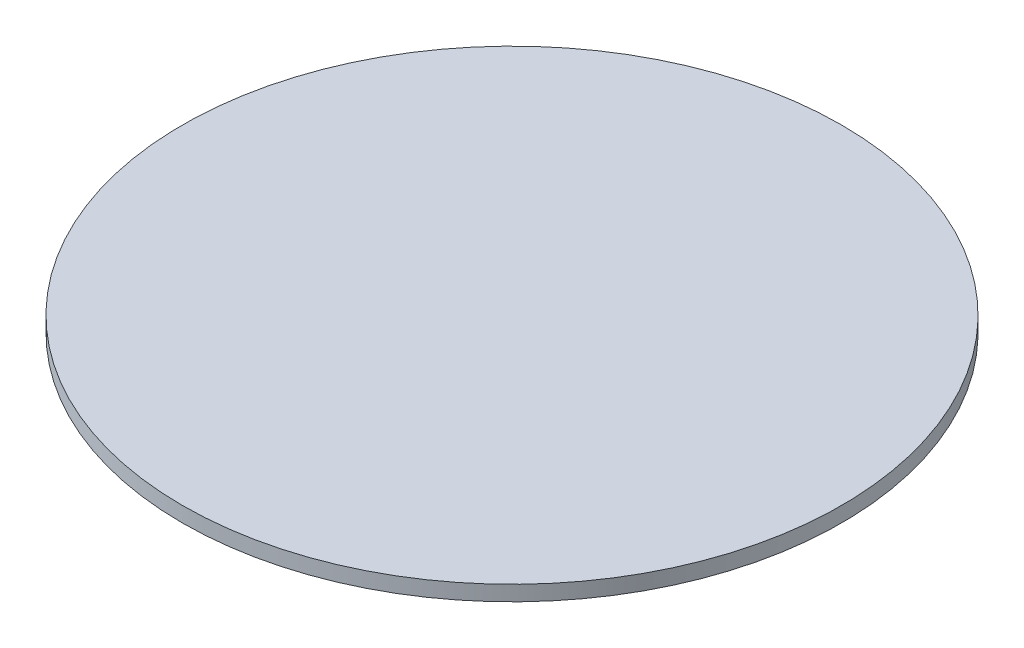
SolidWorks part; units mm, degrees
ref_plane "Alzado" through (0, 0, 0) normal (0, 0, 1) x (1, 0, 0)
ref_plane "Planta" through (0, 0, 0) normal (0, 1, 0) x (1, 0, 0)
ref_plane "Vista lateral" through (0, 0, 0) normal (1, 0, 0) x (0, 0, -1)
sketch "Croquis1" plane through (0, 0, 0) normal (0, 1, 0) x (1, 0, 0)
  circle A0 centre (0, 0) radius 6.5
extrude "Saliente-Extruir1" add sketch "Croquis1" along normal blind 0.3
